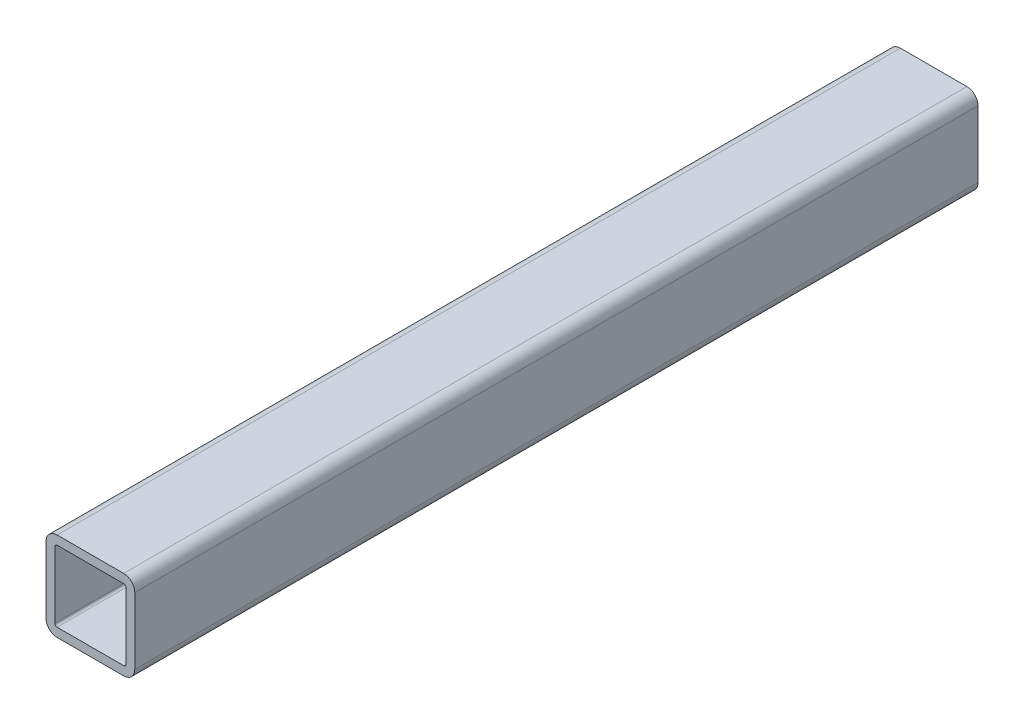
SolidWorks part; units mm, degrees
ref_plane "Plan de face" through (0, 0, 0) normal (0, 0, 1) x (1, 0, 0)
ref_plane "Plan de dessus" through (0, 0, 0) normal (0, 1, 0) x (1, 0, 0)
ref_plane "Plan de droite" through (0, 0, 0) normal (1, 0, 0) x (0, 0, -1)
sketch "Esquisse2" plane through (0, 0, 0) normal (0, 0, 1) x (1, 0, 0)
  line L1 (-7.5, 10) -> (7.5, 10)
  line L2 (-10, 7.5) -> (-10, -7.5)
  line L3 (-7.5, -10) -> (7.5, -10)
  line L4 (10, 7.5) -> (10, -7.5)
  line L5 (-10, 7.5) -> (-10, 10) construction
  line L6 (-10, 10) -> (-7.5, 10) construction
  line L7 (-7.5, 8) -> (7.5, 8)
  line L8 (8, 7.5) -> (8, -7.5)
  line L9 (-7.5, -8) -> (7.5, -8)
  line L10 (-8, 7.5) -> (-8, -7.5)
  line L11 (-7.5, -7.5) -> (7.5, 7.5) construction
  arc A0 (-10, -7.5) -> (-7.5, -10) centre (-7.5, -7.5) ccw
  arc A1 (7.5, -10) -> (10, -7.5) centre (7.5, -7.5) ccw
  arc A2 (7.5, 10) -> (10, 7.5) centre (7.5, 7.5) cw
  arc A3 (-7.5, 10) -> (-10, 7.5) centre (-7.5, 7.5) ccw
  arc A4 (7.5, 8) -> (8, 7.5) centre (7.5, 7.5) cw
  arc A5 (7.5, -8) -> (8, -7.5) centre (7.5, -7.5) ccw
  arc A6 (-8, -7.5) -> (-7.5, -8) centre (-7.5, -7.5) ccw
  arc A7 (-7.5, 8) -> (-8, 7.5) centre (-7.5, 7.5) ccw
  point P4 (0, 0)
  point P14 (-10, 10)
  dimension "D1" = 2.5
  dimension "D2" = 20
  dimension "D3" = 20
  dimension "D4" = 2
extrude "Boss.-Extru.1" add sketch "Esquisse2" along normal mid plane 190
